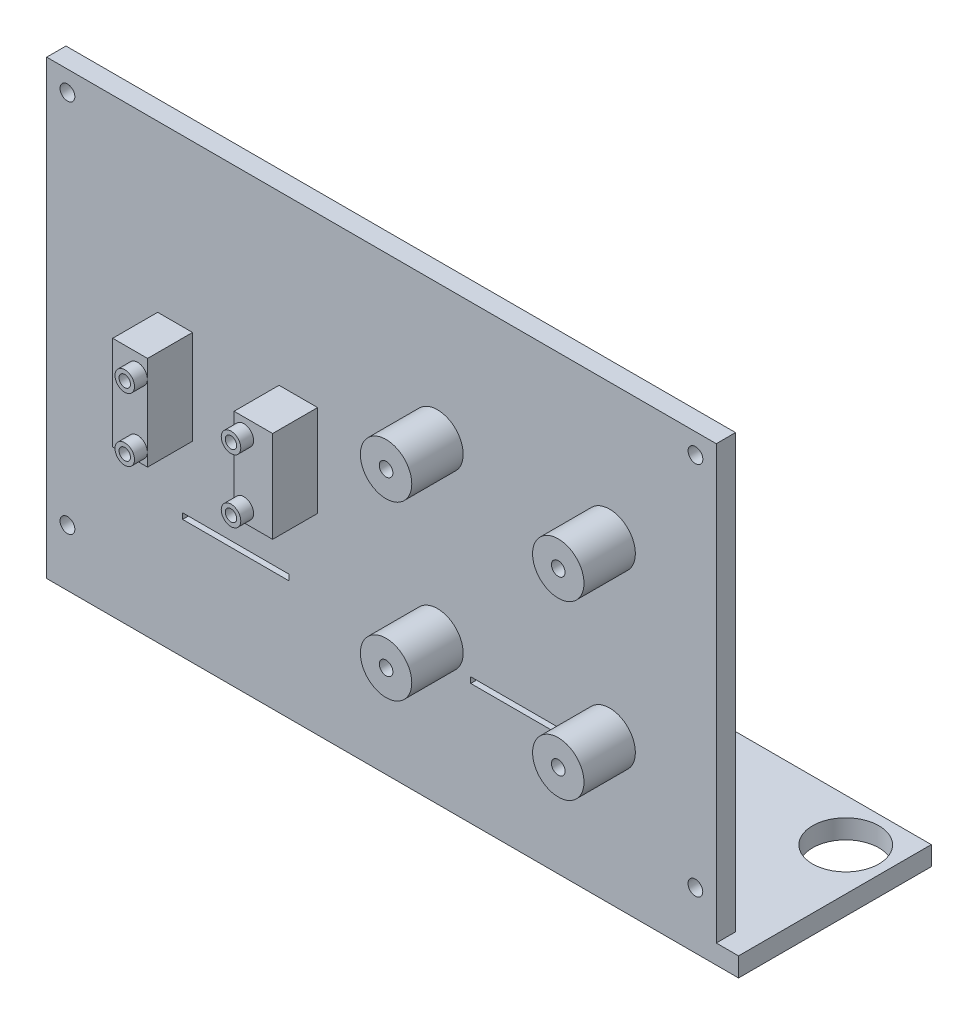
SolidWorks part; units mm, degrees
ref_plane "Front Plane" through (0, 0, 0) normal (0, 0, 1) x (1, 0, 0)
ref_plane "Top Plane" through (0, 0, 0) normal (0, 1, 0) x (1, 0, 0)
ref_plane "Right Plane" through (0, 0, 0) normal (1, 0, 0) x (0, 0, -1)
sketch "Sketch2" plane through (0, 0, 0) normal (0, 0, 1) x (1, 0, 0)
  line L0 (49.7032, -10.8625) -> (70.7032, -10.8625)
  line L1 (98.2397, 53.3019) -> (-34.1056, 53.3019)
  line L2 (98.2397, 53.3019) -> (98.2397, -32.1719)
  line L3 (98.2397, -32.1719) -> (-34.1056, -32.1719)
  line L4 (-34.1056, 53.3019) -> (-34.1056, -32.1719)
  line L5 (-7.2538, -11.2599) -> (13.7462, -11.2599)
  line L6 (-7.2538, -11.2599) -> (-7.2538, -12.4029)
  line L7 (-7.2538, -12.4029) -> (13.7462, -12.4029)
  line L8 (13.7462, -11.2599) -> (13.7462, -12.4029)
  line L9 (49.7032, -10.8625) -> (49.7032, -12.0055)
  line L10 (49.7032, -12.0055) -> (70.7032, -12.0055)
  line L11 (70.7032, -10.8625) -> (70.7032, -12.0055)
  circle A2 centre (77.1699, -7.5568) radius 1.3462
  circle A3 centre (77.1699, 26.4792) radius 1.3462
  circle A4 centre (43.1339, 26.4792) radius 1.3462
  circle A5 centre (43.1339, -7.5568) radius 1.3462
  circle A8 centre (13.7519, 17.0055) radius 1.1303
  circle A9 centre (13.7519, 4.5055) radius 1.1303
  circle A10 centre (-7.2481, 17.0055) radius 1.1303
  circle A11 centre (-7.2481, 4.5055) radius 1.1303
  point P11 (99.6534, 51.7308)
extrude "Boss-Extrude2" add sketch "Sketch2" along normal blind 3.81
sketch "Sketch4" plane through (0, 0, 0) normal (0, 0, 1) x (1, 0, 0)
  circle A8 centre (43.1339, 26.4792) radius 1.3462
  circle A9 centre (43.1339, 26.4792) radius 5.08
  circle A10 centre (77.1699, 26.4792) radius 1.3462
  circle A11 centre (77.1699, 26.4792) radius 5.08
  circle A12 centre (43.1339, -7.5568) radius 1.3462
  circle A13 centre (43.1339, -7.5568) radius 5.08
  circle A14 centre (77.1699, -7.5568) radius 1.3462
  circle A15 centre (77.1699, -7.5568) radius 5.08
extrude "Boss-Extrude8" add sketch "Sketch4" along normal blind 13.97
sketch "Sketch7" plane through (0, 0, 0) normal (0, 0, 1) x (1, 0, 0)
  circle A21 centre (94.112, -24.7537) radius 1.4605
  circle A22 centre (94.112, -24.7537) radius 3.048 construction
  circle A25 centre (94.1327, 49.2944) radius 1.4605
  circle A26 centre (-30.0074, -24.7537) radius 1.4605
  circle A27 centre (-30.0074, -24.7537) radius 3.048 construction
  circle A28 centre (94.1327, 49.2944) radius 3.048 construction
  circle A29 centre (-30.0074, 49.2944) radius 1.4605
  circle A30 centre (-30.0074, 49.2944) radius 3.048 construction
  point P0 (-30.0074, -24.7537)
  point P1 (0, 0)
extrude "Cut-Extrude4" cut sketch "Sketch7" along direction (0, 0, 1) on the side against the normal through all and the other way through all
sketch "Sketch10" plane through (0, 0, 0) normal (0, 0, 1) x (1, 0, 0)
  line L1 (-34.1056, -32.1719) -> (102.6441, -32.1719)
  line L2 (-34.1056, -32.1719) -> (-34.1056, -35.9593)
  line L3 (-34.1056, -35.9593) -> (102.6441, -35.9593)
  line L4 (102.6441, -32.1719) -> (102.6441, -35.9593)
extrude "Boss-Extrude10" add sketch "Sketch10" against normal blind 38.1 from offset 3.81
sketch "Sketch16" plane through (0, -32.1719, 0) normal (0, 1, 0) x (1, 0, 0)
  circle A0 centre (-25.6911, 25.7916) radius 6.5532
  circle A1 centre (94.2296, 25.7916) radius 6.5532
  circle A3 centre (-25.6911, 25.7916) radius 8.2662 construction
  circle A4 centre (94.2296, 25.7916) radius 8.2988 construction
  point P4 (29.8818, 25.4)
  point P6 (-25.6911, 25.7916)
  point P7 (94.2296, 25.7916)
  point P8 (-25.1395, 21.2904)
  point P10 (93.7541, 20.2923)
  point P12 (-34.1056, 21.3619)
extrude "Cut-Extrude8" cut sketch "Sketch16" against normal through all
sketch "Sketch20" plane through (0, 0, 0) normal (0, 0, 1) x (1, 0, 0)
  line L0 (-34.1056, -29.9163) -> (98.2397, -29.9163) construction
  line L1 (-34.1056, 53.3019) -> (-34.1056, -35.9593) construction
  line L2 (98.2397, 53.3019) -> (98.2397, -32.1719) construction
  line L3 (32.067, -29.9163) -> (32.067, 53.3019) construction
  line L4 (98.2397, 53.3019) -> (-34.1056, 53.3019) construction
ref_plane "Plane1" through (32.067, 0, 0) normal (1, 0, 0) x (0, 0, -1)
sketch "Sketch21" plane through (32.067, 0, 0) normal (1, 0, 0) x (0, 0, -1)
  line L0 (0, 53.3019) -> (0, -32.1719)
  line L1 (34.29, -32.1719) -> (-3.81, -32.1719) construction
  line L2 (0, 53.3019) -> (0, -32.1719) construction
  line L3 (0, 53.3019) -> (34.29, -32.1719)
  line L4 (34.29, -32.1719) -> (19.0457, -32.1719)
  line L5 (19.0457, -32.1719) -> (19.0457, -29.9369)
  line L6 (19.0457, -29.9369) -> (0.018, -29.9369)
  line L7 (0.018, -29.9369) -> (0.018, -32.1719)
  line L8 (0.018, -32.1719) -> (0, -32.1719)
extrude "Boss-Extrude11" add sketch "Sketch21" against normal blind 7.62 and the other way blind 2.54
sketch "Sketch22" plane through (0, 0, 3.81) normal (0, 0, 1) x (1, 0, 0)
  line L1 (-5.2796, 1.9719) -> (-12.1731, 1.9719)
  line L2 (-5.2796, 1.9719) -> (-5.2796, 20.5866)
  line L3 (-5.2796, 20.5866) -> (-12.1731, 20.5866)
  line L4 (-12.1731, 1.9719) -> (-12.1731, 20.5866)
  line L5 (11.8215, 1.9719) -> (19.4415, 1.9719)
  line L6 (11.8215, 1.9719) -> (11.8215, 20.0906)
  line L7 (11.8215, 20.0906) -> (19.4415, 20.0906)
  line L8 (19.4415, 1.9719) -> (19.4415, 20.0906)
extrude "Boss-Extrude12" add sketch "Sketch22" along normal blind 8.89
sketch "Sketch23" plane through (0, 0, 12.7) normal (0, 0, 1) x (1, 0, 0)
  circle A1 centre (-7.2481, 17.0055) radius 1.9304
  circle A3 centre (-7.2481, 4.5055) radius 1.9304
  circle A5 centre (13.7519, 17.0055) radius 1.9304
  circle A7 centre (13.7519, 4.5055) radius 1.9304
  point P12 (-7.2481, 17.0055)
  point P14 (-7.2481, 4.5055)
  point P16 (13.7519, 4.5055)
  point P18 (13.7519, 17.0055)
extrude "Boss-Extrude13" add sketch "Sketch23" along normal blind 2.54
sketch "Sketch24" plane through (0, 0, 0) normal (0, 0, 1) x (1, 0, 0)
  circle A0 centre (-7.2481, 17.0055) radius 1.1303
  circle A2 centre (-7.2481, 4.5055) radius 1.1303
  circle A4 centre (13.7519, 17.0055) radius 1.1303
  circle A6 centre (13.7519, 4.5055) radius 1.1303
  point P2 (-7.2481, 17.0055)
  point P5 (0, 0)
  point P8 (0, 0)
  point P11 (0, 0)
  point P12 (-7.2481, 17.0055)
  point P13 (14.1106, 17.5796)
  point P14 (13.7519, 17.0055)
  point P15 (0, 0)
  point P16 (-7.2481, 4.5055)
  point P17 (-7.1118, 5.3351)
  point P18 (13.7519, 4.5055)
  point P19 (13.7519, 17.0055)
  point P20 (-7.2481, 17.0055)
  point P21 (-7.2481, 17.0055)
  point P22 (0, 0)
  point P23 (-7.2481, 17.0055)
  point P24 (0, 0)
  point P25 (0, 0)
  point P26 (0, 0)
  point P27 (0, 0)
  point P28 (0, 0)
  point P29 (-7.2481, 17.0055)
  point P30 (-7.2481, 17.0055)
  point P31 (-5.909, 17.3748)
  point P32 (-7.2481, 17.0055)
  point P33 (-7.2481, 17.0055)
  point P35 (0, 0)
  point P36 (0, 0)
  point P38 (-7.2481, 4.5055)
  point P40 (0, 0)
  point P41 (14.4374, 5.3936)
  point P42 (13.7519, 4.5055)
extrude "Cut-Extrude11" cut sketch "Sketch24" along normal through all
sketch "Sketch25" plane through (0, 0, 0) normal (0, 0, 1) x (1, 0, 0)
  circle A0 centre (-7.2481, 17.0055) radius 5.08
  circle A1 centre (-7.2481, 4.5055) radius 5.08
  circle A2 centre (13.7519, 17.0055) radius 5.08
  circle A3 centre (13.7519, 4.5055) radius 5.08
extrude "Cut-Extrude12" cut sketch "Sketch25" along normal blind 1.27
sketch "Sketch26" plane through (0, 0, 0) normal (0, 0, 1) x (1, 0, 0)
  circle A0 centre (-30.0074, -24.7537) radius 3.048
  circle A1 centre (-30.0074, 49.2944) radius 3.048
  circle A2 centre (94.1327, 49.2944) radius 3.048
  circle A3 centre (94.112, -24.7537) radius 3.048
extrude "Cut-Extrude14" cut sketch "Sketch26" along normal blind 1.27
